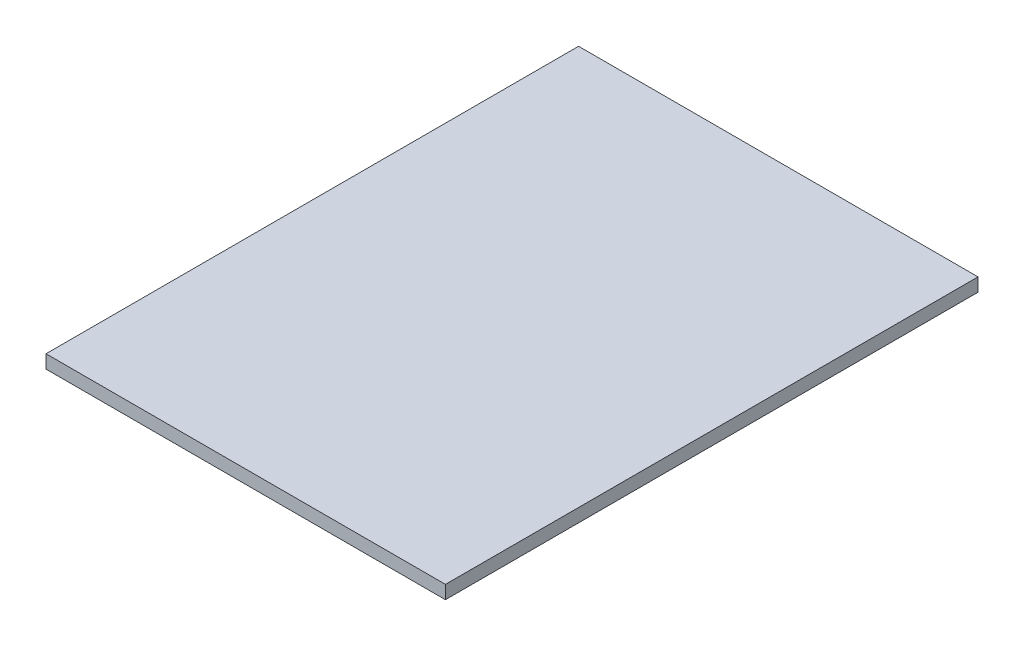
SolidWorks part; units mm, degrees
ref_plane "Front Plane" through (0, 0, 0) normal (0, 0, 1) x (1, 0, 0)
ref_plane "Top Plane" through (0, 0, 0) normal (0, 1, 0) x (1, 0, 0)
ref_plane "Right Plane" through (0, 0, 0) normal (1, 0, 0) x (0, 0, -1)
sketch "Sketch2" plane through (0, 0, 0) normal (0, 1, 0) x (1, 0, 0)
  line L1 (0, 0) -> (150, 0)
  line L2 (0, 0) -> (0, 200)
  line L3 (0, 200) -> (150, 200)
  line L4 (150, 0) -> (150, 200)
  dimension "D1" = 200
  dimension "D2" = 150
extrude "Boss-Extrude1" add sketch "Sketch2" along normal blind 5
